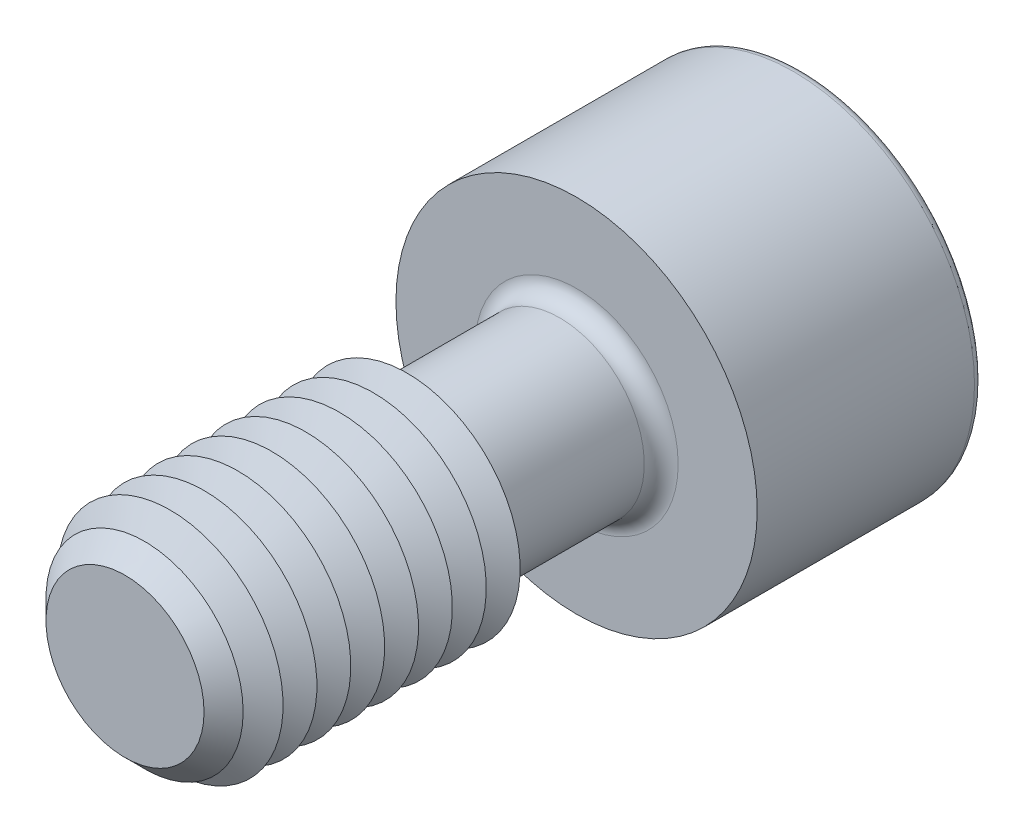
SolidWorks part; units mm, degrees
ref_plane "Front Plane" through (0, 0, 0) normal (0, 0, 1) x (1, 0, 0)
ref_plane "Top Plane" through (0, 0, 0) normal (0, 1, 0) x (1, 0, 0)
ref_plane "Right Plane" through (0, 0, 0) normal (1, 0, 0) x (0, 0, -1)
sketch "Sketch1" plane through (0, 0, 0) normal (0, 0, 1) x (1, 0, 0)
  circle A0 centre (0, 0) radius 3.75
  dimension "D1" = 7.5
extrude "Extrude1" add sketch "Sketch1" along normal mid plane 20
sketch "Sketch2" plane through (0, 0, 0) normal (1, 0, 0) x (0, 0, -1)
  line L0 (-10, 0) -> (-10, 5)
  line L1 (-10, 3.75) -> (-10, -3.75) construction
  line L2 (-10, 5) -> (2.5, 5)
  line L3 (2.5, 5) -> (3.2217, 3.75)
  line L4 (10, 3.75) -> (-10, 3.75) construction
  line L5 (3.2217, 3.75) -> (3.2217, 0)
  line L6 (3.2217, 0) -> (-10, 0)
  dimension "D1" = 5
  dimension "D2" = 120
  dimension "D3" = 12.5
revolve "Revolve1" add sketch "Sketch2" angle 360 about L6
chamfer "Chamfer1" distance 1.5 angle 45 1 edges at (0, 5, 10)
sketch "Sketch3" plane through (0, 0, -10) normal (0, 0, -1) x (-1, 0, 0)
  circle A0 centre (0, 0) radius 8
  dimension "D1" = 16
extrude "Extrude2" add sketch "Sketch3" along normal blind 10
sketch "Sketch4" plane through (-13.7, 0, -20) normal (0, 0, 1) x (1, 0, 0)
  line L2 (11.3906, -4) -> (16.0094, -4)
  line L3 (16.0094, -4) -> (18.3188, 0)
  line L4 (18.3188, 0) -> (16.0094, 4)
  line L6 (16.0094, 4) -> (11.3906, 4)
  line L7 (11.3906, 4) -> (9.0812, 0)
  line L8 (9.0812, 0) -> (11.3906, -4)
  circle A0 centre (13.7, 0) radius 4 construction
  dimension "D1" = 8
extrude "Extrude3" cut sketch "Sketch4" along normal blind 8
fillet "Fillet1" radius 0.75 1 edges at (-3.75, 0, -10)
fillet "Fillet2" radius 0.375 1 edges at (-8, 0, -20)
sketch "Sketch5" plane through (0, 0, 0) normal (1, 0, 0) x (0, 0, -1)
  line L0 (12, 0) -> (12, -4)
  line L1 (12, -4) -> (9.6906, 0)
  line L2 (9.6906, 0) -> (12, 0)
  dimension "D1" = 30
revolve "Cut-Revolve1" cut sketch "Sketch5" angle 360 about L2
sketch "Sketch6" plane through (0, 0, 0) normal (1, 0, 0) x (0, 0, -1)
  line L0 (1.332, 0) -> (-13.289, 0) construction
sketch "Sketch7" plane through (0, 0, 0) normal (1, 0, 0) x (0, 0, -1)
  line L0 (2.5, 5) -> (1.75, 3.701)
  line L1 (1.75, 3.701) -> (1, 5)
  line L2 (2.5, 5) -> (-8.5, 5) construction
  line L3 (1, 5) -> (2.5, 5)
  dimension "D1" = 1.5
revolve "Cut-Revolve2" cut sketch "Sketch7" angle 360 about L0
pattern_linear "LPattern1" count 8 spacing 1.5 along (0, 0, 1) of "Cut-Revolve2"
